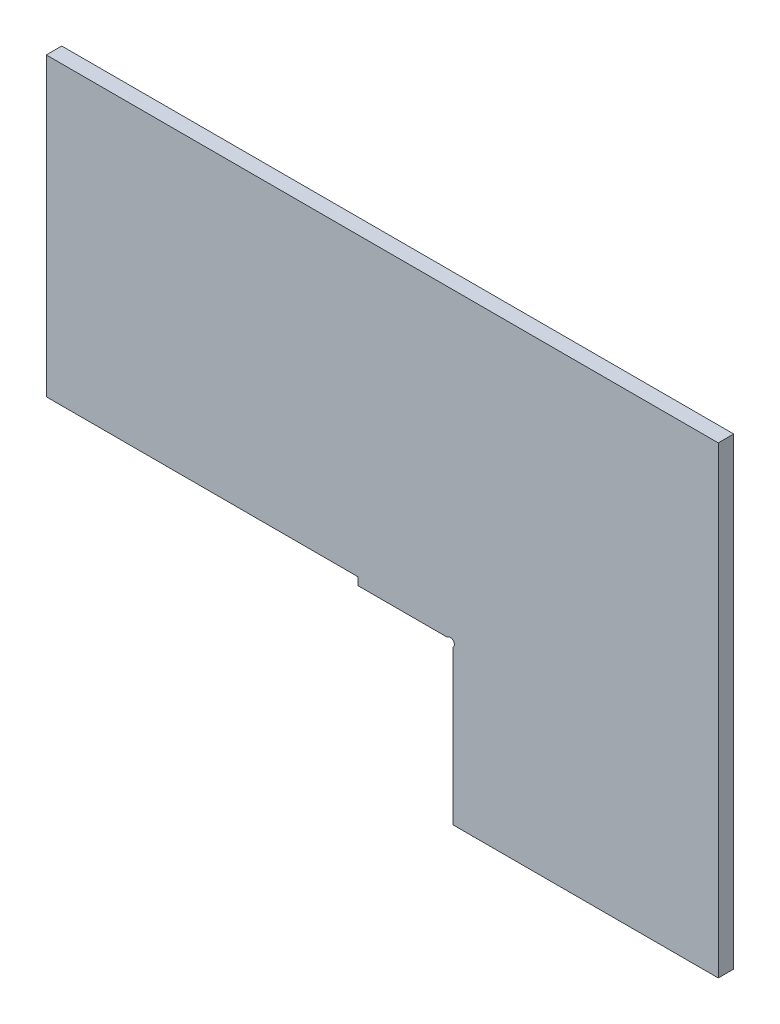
SolidWorks part; units mm, degrees
ref_plane "Face" through (0, 0, 0) normal (0, 0, 1) x (1, 0, 0)
ref_plane "Dessus" through (0, 0, 0) normal (0, 1, 0) x (1, 0, 0)
ref_plane "Droite" through (0, 0, 0) normal (1, 0, 0) x (0, 0, -1)
sketch "Esquisse1" plane through (0, 0, 0) normal (0, 0, 1) x (1, 0, 0)
  line L0 (-58.4405, 127.9128) -> (202.5595, 127.9128)
  line L1 (202.5595, 127.9128) -> (202.5595, -52.0872)
  line L2 (202.5595, -52.0872) -> (99.5595, -52.0872)
  line L3 (99.5595, -52.0872) -> (99.5595, 12.9128)
  line L4 (99.5595, 12.9128) -> (-58.4405, 12.9128)
  line L5 (-58.4405, 12.9128) -> (-58.4405, 127.9128)
  dimension "D1" = 261
  dimension "D2" = 115
  dimension "D3" = 180
  dimension "D4" = 103
extrude "Extrusion1" add sketch "Esquisse1" along normal blind 6
sketch "Esquisse3" plane through (0, 0, 6) normal (0, 0, 1) x (1, 0, 0)
  line L1 (99.5595, 12.9128) -> (62.5595, 12.9128)
  line L2 (99.5595, 12.9128) -> (99.5595, 9.9128)
  line L3 (99.5595, 9.9128) -> (62.5595, 9.9128)
  line L4 (62.5595, 12.9128) -> (62.5595, 9.9128)
  dimension "D1" = 37
  dimension "D2" = 3
extrude "Extrusion2" add sketch "Esquisse3" against normal up to vertex (6 mm away)
sketch "Esquisse2" plane through (0, 0, 6) normal (0, 0, 1) x (1, 0, 0)
  line L2 (62.5595, 9.9128) -> (99.5595, 9.9128) construction
  line L3 (99.5595, 9.9128) -> (99.5595, -52.0872) construction
  circle A0 centre (98.4595, 8.8128) radius 1.6
  dimension "D1" = 1.1
  dimension "D2" = 1.1
extrude "Enlèv. mat.-Extru.1" cut sketch "Esquisse2" against normal up to vertex (6 mm away)
